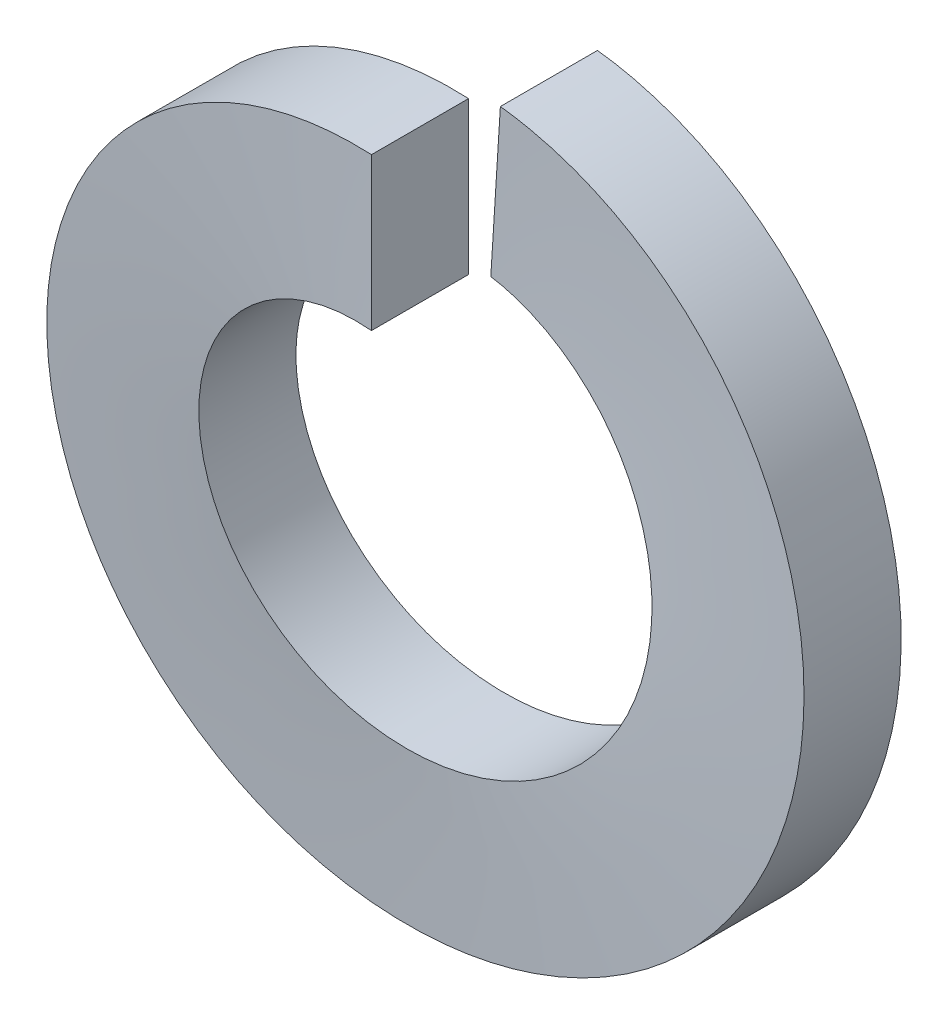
SolidWorks part; units mm, degrees
ref_plane "Front Plane" through (0, 0, 0) normal (0, 0, 1) x (1, 0, 0)
ref_plane "Top Plane" through (0, 0, 0) normal (0, 1, 0) x (1, 0, 0)
ref_plane "Right Plane" through (0, 0, 0) normal (1, 0, 0) x (0, 0, -1)
sketch "Sketch1" plane through (0, 0, 0) normal (0, 0, 1) x (1, 0, 0)
  line L0 (0, 8.636) -> (0, 4.8895) construction
  circle A0 centre (0, 0) radius 8.636
  circle A1 centre (0, 0) radius 4.8895 construction
  dimension "ID" = 9.779
  dimension "OD" = 17.272
curve "Helix/Spiral1" parameters "HT"=2.6264
sketch "Sketch2" plane through (0, 0, 0) normal (1, 0, 0) x (0, 0, -1)
  line L1 (0, 8.636) -> (-2.3876, 8.636)
  line L2 (0, 8.636) -> (0, 4.8895)
  line L3 (0, 4.8895) -> (-2.3876, 4.8895)
  line L4 (-2.3876, 8.636) -> (-2.3876, 4.8895)
sweep "Sweep1" add profiles "Sketch2" path "Helix/Spiral1"
equation "\"HT@Helix/Spiral1\" = \"THK@Sketch2\"*1.1"
